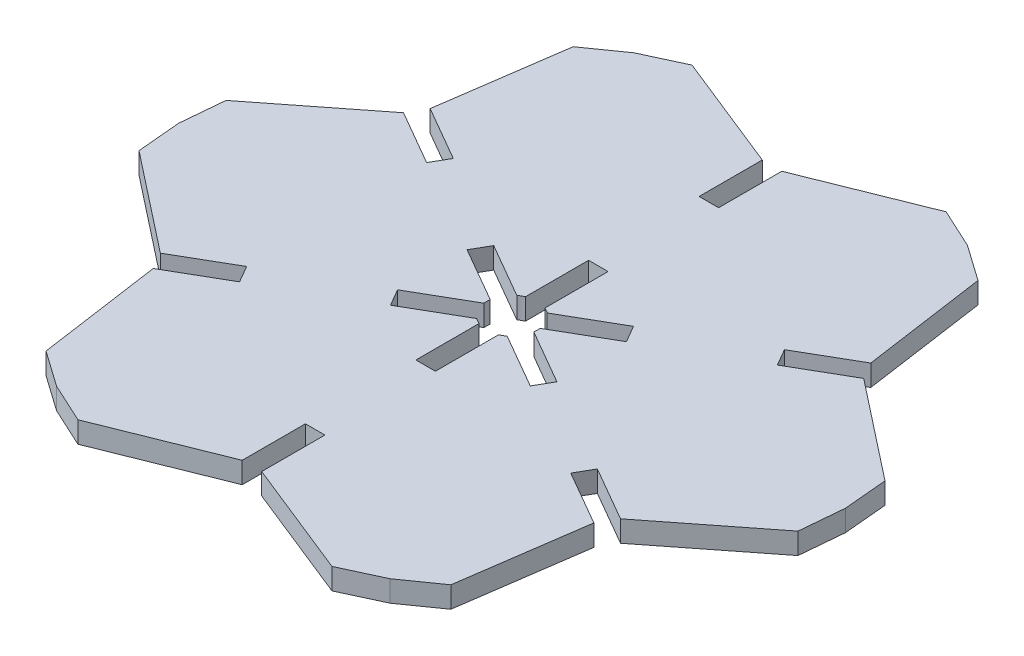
SolidWorks part; units mm, degrees
ref_plane "Alzado" through (0, 0, 0) normal (0, 0, 1) x (1, 0, 0)
ref_plane "Planta" through (0, 0, 0) normal (0, 1, 0) x (1, 0, 0)
ref_plane "Vista lateral" through (0, 0, 0) normal (1, 0, 0) x (0, 0, -1)
sketch "Croquis1" plane through (0, 0, 0) normal (0, 1, 0) x (1, 0, 0)
  line L0 (-16, 36.6197) -> (-1.15, 30.6634) construction
  line L1 (-1.15, 30.6634) -> (-1.15, 23.2114) construction
  line L2 (-1.15, 23.2114) -> (1.15, 23.2114) construction
  line L3 (1.15, 23.2114) -> (1.15, 30.6634) construction
  line L4 (1.15, 30.6634) -> (16, 36.6197) construction
  line L5 (16, 36.6197) -> (29.0824, 27.4083) construction
  line L6 (-16, 36.6197) -> (-29.0824, 27.4083) construction
  line L7 (0, 23.2114) -> (0, 0) construction
  line L8 (-16, 36.6197) -> (16, 36.6197) construction
  line L9 (-29.0824, 27.4083) -> (-29.0824, 103.2114) construction
  line L10 (-29.0824, 103.2114) -> (29.0824, 103.2114) construction
  line L11 (29.0824, 103.2114) -> (29.0824, 27.4083) construction
  circle A0 centre (0, 0) radius 39.9625
  circle A1 centre (0, 0) radius 2.9625
extrude "Saliente-Extruir1" add sketch "Croquis1" along normal mid plane 2.5 contours A0
sketch "Croquis2" plane through (0, 1.25, 0) normal (0, 1, 0) x (1, 0, 0)
  line L0 (-29.0824, 103.2114) -> (29.0824, 103.2114) construction
  line L1 (-1.15, 23.2114) -> (1.15, 23.2114) construction
  line L2 (-29.0824, 27.4083) -> (-29.0824, 103.2114) construction
  line L3 (-16, 36.6197) -> (-29.0824, 27.4083) construction
  line L4 (-16, 36.6197) -> (-1.15, 30.6634) construction
  line L5 (-1.15, 30.6634) -> (-1.15, 23.2114) construction
  line L6 (1.15, 23.2114) -> (1.15, 30.6634) construction
  line L7 (1.15, 30.6634) -> (16, 36.6197) construction
  line L8 (16, 36.6197) -> (29.0824, 27.4083) construction
  line L9 (29.0824, 103.2114) -> (29.0824, 27.4083) construction
  line L10 (-29.0824, 103.2114) -> (29.0824, 103.2114)
  line L11 (-1.15, 23.2114) -> (1.15, 23.2114)
  line L12 (-29.0824, 27.4083) -> (-29.0824, 103.2114)
  line L13 (-16, 36.6197) -> (-29.0824, 27.4083)
  line L14 (-16, 36.6197) -> (-1.15, 30.6634)
  line L15 (-1.15, 30.6634) -> (-1.15, 23.2114)
  line L16 (1.15, 23.2114) -> (1.15, 30.6634)
  line L17 (1.15, 30.6634) -> (16, 36.6197)
  line L18 (16, 36.6197) -> (29.0824, 27.4083)
  line L19 (29.0824, 103.2114) -> (29.0824, 27.4083)
  line L20 (-1.15, 2.7302) -> (-1.15, 10.1822)
  line L21 (-1.15, 10.1822) -> (1.15, 10.1822)
  line L22 (1.15, 10.1822) -> (1.15, 2.7302)
  circle A1 centre (0, 0) radius 2.9625 construction
  arc A2 (-1.15, 2.7302) -> (1.15, 2.7302) centre (0, 0) cw
extrude "Cortar-Extruir2" cut sketch "Croquis2" against normal through all and the other way through all
pattern_circular "MatrizC1" count 6 over 360 about axis through (0, 0, 0) along (0, 1, 0) of "Cortar-Extruir2"
equation "\"Diameter\"= 80"
equation "\"Kerf\"= 0.15"
equation "\"D3@Croquis1\"=\"Diameter\"*0.4"
equation "\"Thickness\"= 2.5"
equation "\"N_Sides\"= 6"
equation "\"D2@Croquis1\"=\"Diameter\" / 6+\"Kerf\"/2"
equation "\"D7@Croquis1\"=\"Diameter\""
equation "\"D1@Saliente-Extruir1\"=\"Thickness\""
equation "\"D1@MatrizC1\"=\"N_Sides\""
equation "\"D4@Croquis1\"=\"Thickness\" -\"Kerf\" -0.05"
equation "\"D_Hole\"= 6"
equation "\"D8@Croquis1\"=\"D_Hole\"-\"Kerf\"/2"
equation "\"D1@Croquis1\"=\"Diameter\"-\"Kerf\"/2"
equation "\"D5@Croquis1\"=\"D3@Croquis1\"/2"
